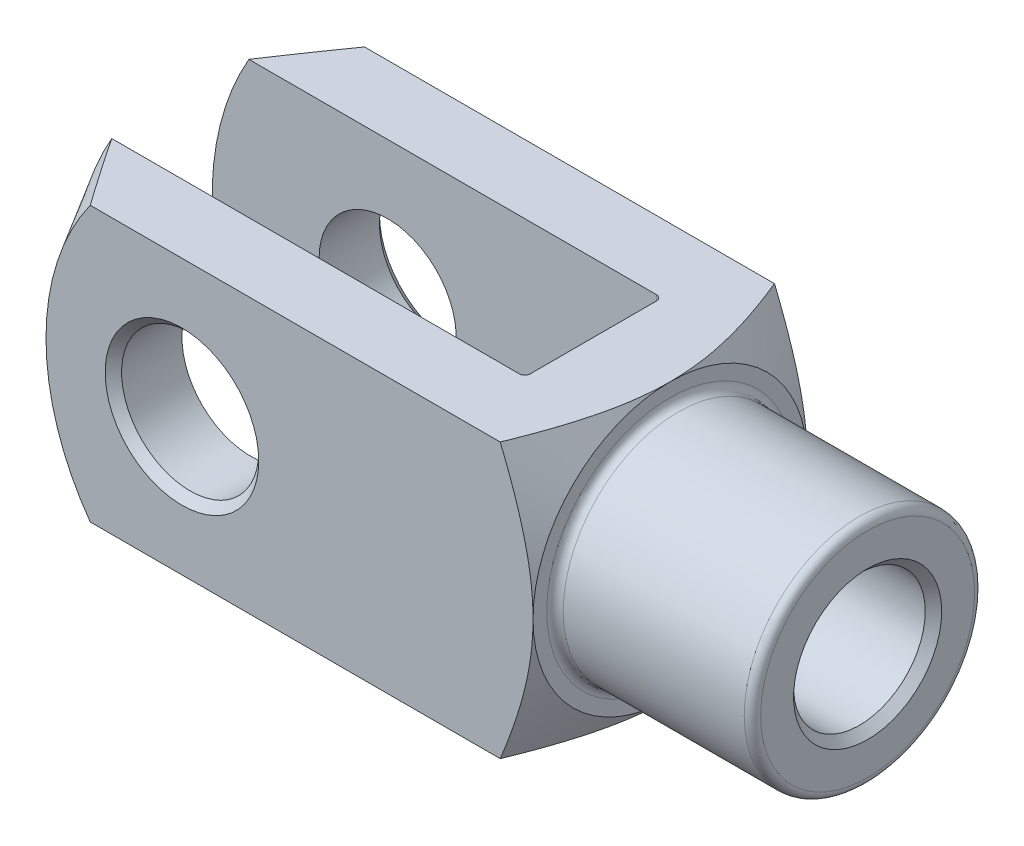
SolidWorks part; units mm, degrees
ref_plane "Front Plane" through (0, 0, 0) normal (0, 0, 1) x (1, 0, 0)
ref_plane "Top Plane" through (0, 0, 0) normal (0, 1, 0) x (1, 0, 0)
ref_plane "Right Plane" through (0, 0, 0) normal (1, 0, 0) x (0, 0, -1)
sketch "Sketch1" plane through (0, 0, 0) normal (1, 0, 0) x (0, 0, -1)
  line L0 (0, 0) -> (0, 50000) construction
  line L1 (0, 0) -> (50000, 0) construction
  line L2 (-25, -25) -> (-25, 25)
  line L3 (-25, 25) -> (25, 25)
  line L4 (25, -25) -> (25, 25)
  line L5 (-25, -25) -> (25, -25)
  point P9 (0, 25)
  point P11 (25, 0)
  point P12 (-25, 0)
  dimension "D1" = 50
  dimension "D2" = 50
extrude "Extrude1" add sketch "Sketch1" against normal blind 132
sketch "Sketch2" plane through (0, 0, 0) normal (1, 0, 0) x (0, 0, -1)
  circle A0 centre (0, 0) radius 21
  circle A1 centre (0, 0) radius 42
  dimension "D1" = 42
  dimension "D2" = 84
extrude "Extrude2" cut sketch "Sketch2" against normal blind 36
sketch "Sketch3" plane through (0, 0, 25) normal (0, 0, 1) x (1, 0, 0)
  circle A0 centre (-100, 0) radius 12.5
  dimension "D1" = 25
  dimension "D2" = 100
extrude "Extrude3" cut sketch "Sketch3" against normal through all
sketch "Sketch4" plane through (0, 25, 0) normal (0, 1, 0) x (1, 0, 0)
  line L0 (0, 0) -> (-50000, 0) construction
  line L1 (-132, -12.5) -> (-132, 12.5)
  line L2 (-132, 25) -> (-132, -25) construction
  line L3 (-132, 12.5) -> (-50, 12.5)
  line L4 (-50, 12.5) -> (-50, -12.5)
  line L5 (-100, 25) -> (-100, -25) construction
  line L6 (-132, -12.5) -> (-50, -12.5)
  point P7 (-100, 0)
  point P13 (-50, 0)
  point P14 (-132, 0)
  dimension "D1" = 50
  dimension "D2" = 25
extrude "Extrude4" cut sketch "Sketch4" against normal through all
fillet "Fillet1" radius 1 2 edges at (-50, 0, 12.5) (-50, 0, -12.5)
fillet "Fillet2" radius 1.5 2 edges at (0, 0, -21) (-36, 0, -21)
chamfer "Chamfer2" distance 1.5 angle 45 2 edges at (-87.5, 0, -25) (-87.5, 0, 25)
sketch "Sketch6" plane through (0, 0, 0) normal (0, 0, 1) x (1, 0, 0)
  line L0 (-36, -25) -> (-36, -50)
  line L1 (-36, -50) -> (-50.4338, -50)
  line L2 (-50.4338, -50) -> (-36, -25)
  dimension "D1" = 30
  dimension "D2" = 50
revolve "Cut-Revolve1" cut sketch "Sketch6" angle 360 about axis through (-36, 0, 0) along (1, 0, 0)
sketch "Sketch7" plane through (0, 0, 0) normal (0, 1, 0) x (1, 0, 0)
  line L0 (-124.7831, -25) -> (-132, -12.5)
  line L1 (-132, 12.5) -> (-124.7831, 25)
  line L2 (-124.7831, 25) -> (-182, 25)
  line L3 (-132, 12.5) -> (-132, -12.5)
  line L4 (-182, 25) -> (-182, -25)
  line L5 (-182, -25) -> (-124.7831, -25)
  line L6 (-132, 25) -> (-41.9787, 25) construction
  line L7 (-132, -25) -> (-41.9787, -25) construction
  line L8 (-82, 0.6162) -> (-82, 50000.6162) construction
  dimension "D1" = 120
  dimension "D2" = 50
  dimension "D3" = 50
revolve "Cut-Revolve2" cut sketch "Sketch7" angle 180 about L8
sketch "Sketch8" plane through (0, 0, 0) normal (1, 0, 0) x (0, 0, -1)
  circle A0 centre (0, 0) radius 12
  dimension "D1" = 24
extrude "Extrude5" cut sketch "Sketch8" against normal through all
chamfer "Chamfer3" distance 1.5 angle 45 1 edges at (0, 0, -12)
equation "\"D2@Sketch1\" = \"D1@Sketch1\""
equation "\"D2@Sketch2\" = \"D1@Sketch2\"*2"
equation "\"D2@Sketch6\" = \"D1@Sketch1\""
equation "\"D2@Sketch7\" = \"D1@Sketch1\""
equation "\"D3@Sketch7\" = \"D1@Sketch1\""
